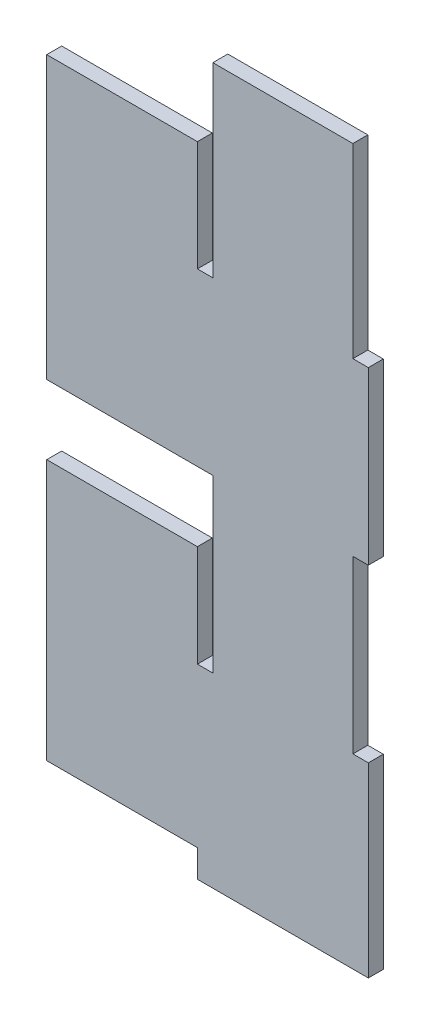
SolidWorks part; units mm, degrees
ref_plane "Alzado" through (0, 0, 0) normal (0, 0, 1) x (1, 0, 0)
ref_plane "Planta" through (0, 0, 0) normal (0, 1, 0) x (1, 0, 0)
ref_plane "Vista lateral" through (0, 0, 0) normal (1, 0, 0) x (0, 0, -1)
sketch "Croquis1" plane through (0, 0, 0) normal (0, 0, 1) x (1, 0, 0)
  line L24 (-6.2, -5.42) -> (62.4, -5.42)
  line L28 (28.1, 275.5) -> (28.1, 154.0206) construction
  line L34 (56.2, 206.72) -> (62.4, 206.72)
  line L41 (22.1, 120) -> (34.1, 190) construction
  line L42 (22.1, 190) -> (34.1, 120) construction
  line L46 (0, 138.04) -> (12, 138.04) construction
  line L51 (56.2, 138.04) -> (62.4, 138.04)
  line L52 (62.4, 206.72) -> (62.4, 138.04)
  line L54 (56.2, 138.04) -> (56.2, 69.36)
  line L55 (56.2, 69.36) -> (62.4, 69.36)
  line L65 (56.2, 281.5) -> (0, 281.5)
  line L66 (56.2, 206.72) -> (56.2, 281.5)
  line L67 (0, 206.72) -> (0, 281.5)
  line L69 (0, 206.72) -> (-6.2, 206.72)
  line L71 (0, 138.04) -> (-6.2, 138.04)
  line L72 (0, 69.36) -> (0, 138.04)
  line L74 (0, 69.36) -> (-6.2, 69.36)
  line L75 (62.4, -5.42) -> (62.4, 69.36)
  line L76 (-6.2, 5.58) -> (-6.2, -5.42)
  line L77 (28.1, 154.0206) -> (4.7366, 154.0206) construction
  line L78 (28.1, -5.42) -> (28.1, 33.6156) construction
  line L80 (-6.2, 5.58) -> (-66.6678, 5.58)
  line L81 (-6.2, 69.36) -> (-6.2, 110.1919)
  line L82 (-6.2, 110.1919) -> (-66.6678, 110.1919)
  line L83 (-66.6678, 5.58) -> (-66.6678, 110.1919)
  line L84 (-6.2, 250.9512) -> (-66.6678, 250.9512)
  line L85 (-6.2, 250.9512) -> (-6.2, 206.72)
  line L86 (-6.2, 138.04) -> (-66.6678, 138.04)
  line L87 (-66.6678, 250.9512) -> (-66.6678, 138.04)
  point P5 (28.1, 155)
  point P7 (28.1, 281.5)
  point P34 (28.1, -5.42)
  dimension "D15" = 143.46
  dimension "D3" = 74.78
  dimension "D4" = 68.68
  dimension "D5" = 68.68
  dimension "D6" = 6.2
  dimension "D7" = 74.78
  dimension "D8" = 70
  dimension "D9" = 12
  dimension "D14" = 286.92
extrude "Saliente-Extruir1" add sketch "Croquis1" along normal mid plane 6
